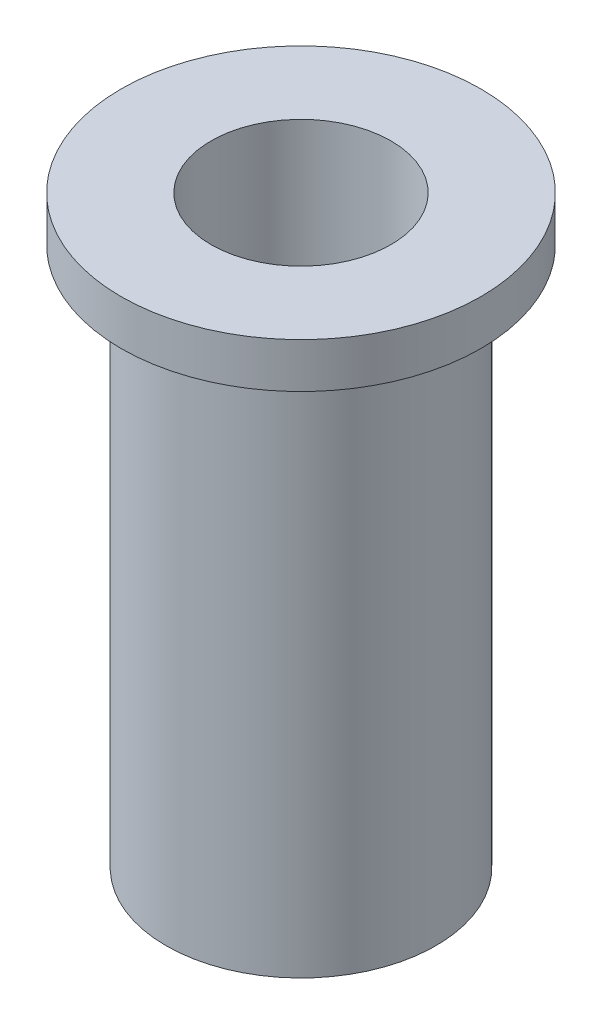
SolidWorks part; units mm, degrees
ref_plane "Front Plane" through (0, 0, 0) normal (0, 0, 1) x (1, 0, 0)
ref_plane "Top Plane" through (0, 0, 0) normal (0, 1, 0) x (1, 0, 0)
ref_plane "Right Plane" through (0, 0, 0) normal (1, 0, 0) x (0, 0, -1)
sketch "Sketch1" plane through (0, 0, 0) normal (0, 1, 0) x (1, 0, 0)
  circle A0 centre (0, 0) radius 6.35
  circle A1 centre (0, 0) radius 3.175
  dimension "D1" = 12.7
  dimension "D2" = 6.35
extrude "Boss-Extrude1" add sketch "Sketch1" against normal blind 20.6375
sketch "Sketch2" plane through (0, -20.6375, 0) normal (0, -1, 0) x (1, 0, 0)
  circle A0 centre (0, 0) radius 4.7625
  dimension "D1" = 9.525
extrude "Cut-Extrude1" cut sketch "Sketch2" against normal blind 19.05 flip side to cut
